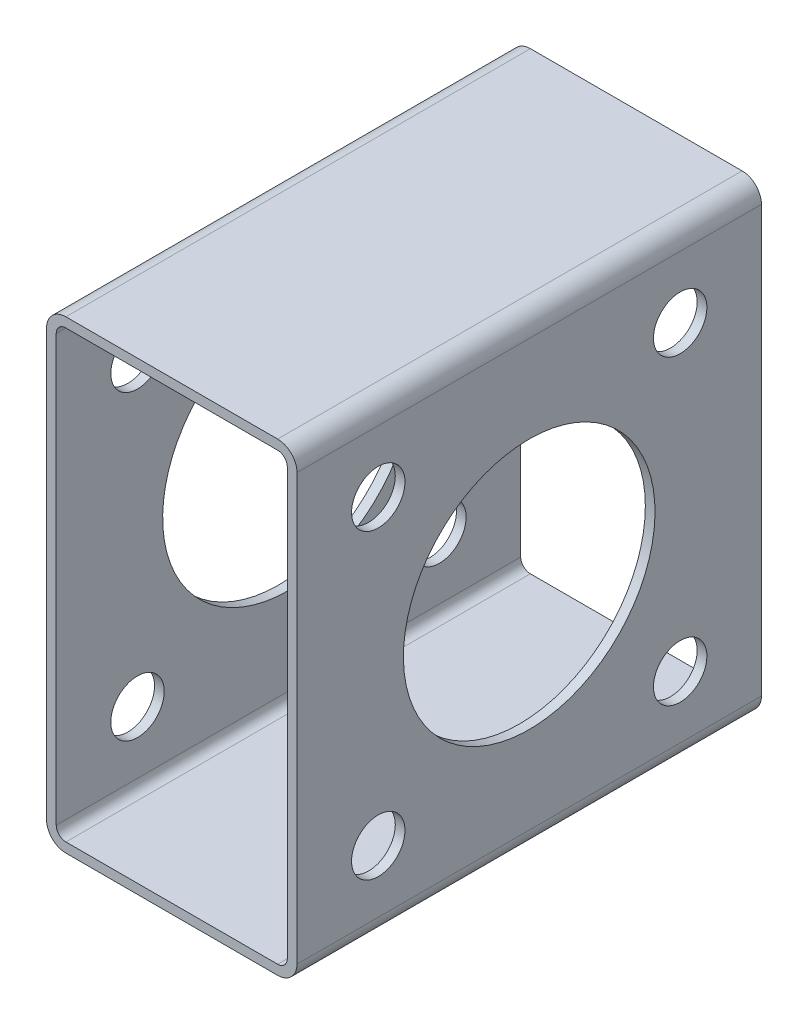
SolidWorks part; units mm, degrees
ref_plane "Plane1" through (0, 0, 0) normal (0, 0, 1) x (1, 0, 0)
ref_plane "Plane2" through (0, 0, 0) normal (0, 1, 0) x (1, 0, 0)
ref_plane "Plane3" through (0, 0, 0) normal (1, 0, 0) x (0, 0, -1)
sketch "Sketch1" plane through (0, 0, 0) normal (0, 0, 1) x (1, 0, 0)
  line L0 (-34.925, -69.85) -> (-34.925, 69.85)
  line L1 (-31.75, -76.2) -> (37.719, -76.2)
  line L2 (-38.1, -69.85) -> (-38.1, 69.85)
  line L3 (-31.75, 76.2) -> (37.719, 76.2)
  line L4 (44.069, -69.85) -> (44.069, 69.85)
  line L5 (-31.75, 73.025) -> (37.719, 73.025)
  line L6 (40.894, -69.85) -> (40.894, 69.85)
  line L7 (-31.75, -73.025) -> (37.719, -73.025)
  arc A0 (-31.75, 73.025) -> (-34.925, 69.85) centre (-31.75, 69.85) ccw
  arc A1 (40.894, 69.85) -> (37.719, 73.025) centre (37.719, 69.85) ccw
  arc A2 (40.894, -69.85) -> (37.719, -73.025) centre (37.719, -69.85) cw
  arc A3 (-34.925, -69.85) -> (-31.75, -73.025) centre (-31.75, -69.85) ccw
  arc A4 (-38.1, -69.85) -> (-31.75, -76.2) centre (-31.75, -69.85) ccw
  arc A5 (44.069, -69.85) -> (37.719, -76.2) centre (37.719, -69.85) cw
  arc A6 (44.069, 69.85) -> (37.719, 76.2) centre (37.719, 69.85) ccw
  arc A7 (-31.75, 76.2) -> (-38.1, 69.85) centre (-31.75, 69.85) ccw
  dimension "D1" = 3.175
  dimension "D2" = 6.35
  dimension "D3" = 82.169
  dimension "D4" = 152.4
extrude "CHANNEL" add sketch "Sketch1" along normal blind 152.4
sketch "Sketch2" plane through (44.069, 0, 0) normal (1, 0, 0) x (0, 0, -1)
  line L0 (-76.2, 76.2) -> (-76.2, -76.2) construction
  line L1 (-152.4, 76.2) -> (0, 76.2) construction
  line L2 (-152.4, -76.2) -> (0, -76.2) construction
  line L3 (-152.4, 0) -> (0, 0) construction
  line L4 (-152.4, -69.85) -> (-152.4, 69.85) construction
  circle A0 centre (-76.2, 0) radius 41.275
  circle A1 centre (-125.73, 49.53) radius 8.763
  circle A2 centre (-26.67, 49.53) radius 8.763
  circle A3 centre (-26.67, -49.53) radius 8.763
  circle A4 centre (-125.73, -49.53) radius 8.763
  dimension "D1" = 49.53
  dimension "D2" = 49.53
  dimension "D3" = 82.55
extrude "HOLES1" cut sketch "Sketch2" against normal up to next
sketch "Sketch4" plane through (-38.1, 0, 0) normal (-1, 0, 0) x (0, 0, 1)
  line L0 (76.2, 76.2) -> (76.2, -76.2) construction
  line L1 (152.4, 76.2) -> (0, 76.2) construction
  line L2 (152.4, -76.2) -> (0, -76.2) construction
  circle A0 centre (76.2, 0) radius 41.275
  circle A1 centre (26.67, 49.53) radius 8.763
  circle A2 centre (125.73, 49.53) radius 8.763
  circle A3 centre (26.67, -49.53) radius 8.763
  circle A4 centre (125.73, -49.53) radius 8.763
  circle A5 centre (76.2, 0) radius 41.275 construction
extrude "HOLES2" cut sketch "Sketch4" against normal up to next
